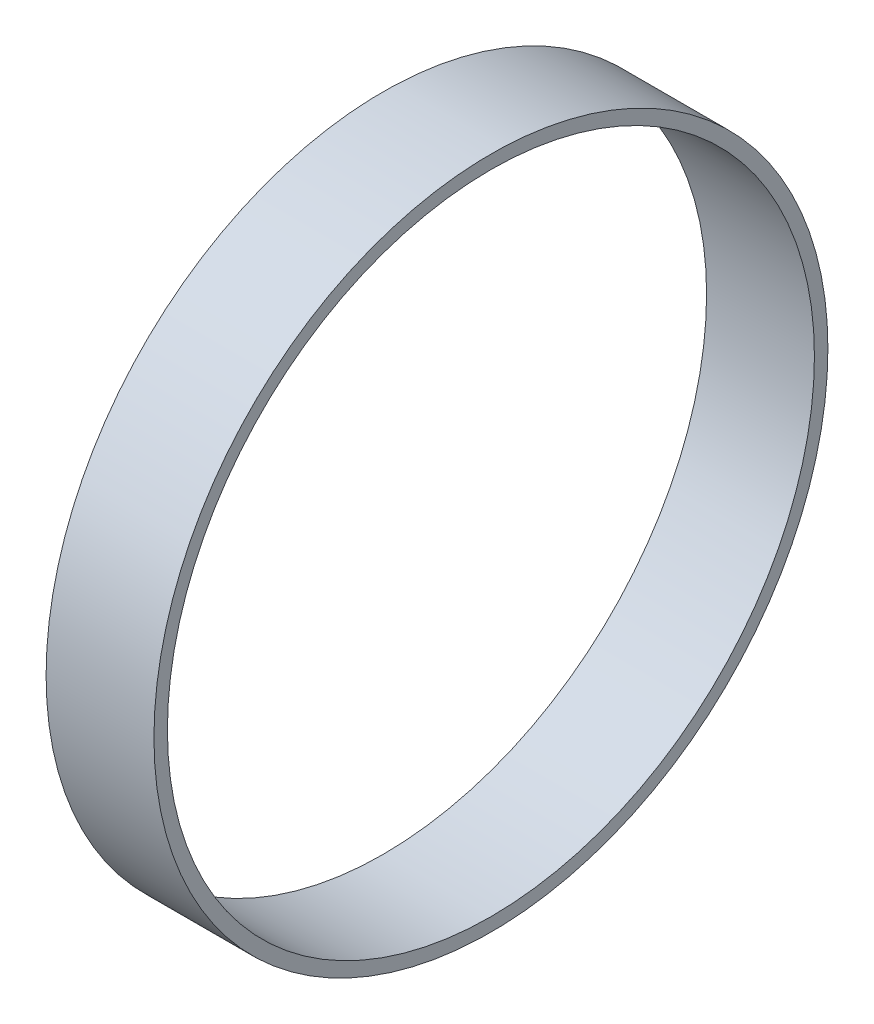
SolidWorks part; units mm, degrees
ref_plane "Plan de face" through (0, 0, 0) normal (0, 0, 1) x (1, 0, 0)
ref_plane "Plan de dessus" through (0, 0, 0) normal (0, 1, 0) x (1, 0, 0)
ref_plane "Plan de droite" through (0, 0, 0) normal (1, 0, 0) x (0, 0, -1)
sketch "Esquisse1" plane through (0, 0, 0) normal (1, 0, 0) x (0, 0, -1)
  circle A0 centre (0, 0) radius 24
  circle A1 centre (0, 0) radius 25
extrude "Extrusion1" add sketch "Esquisse1" along normal blind 8
